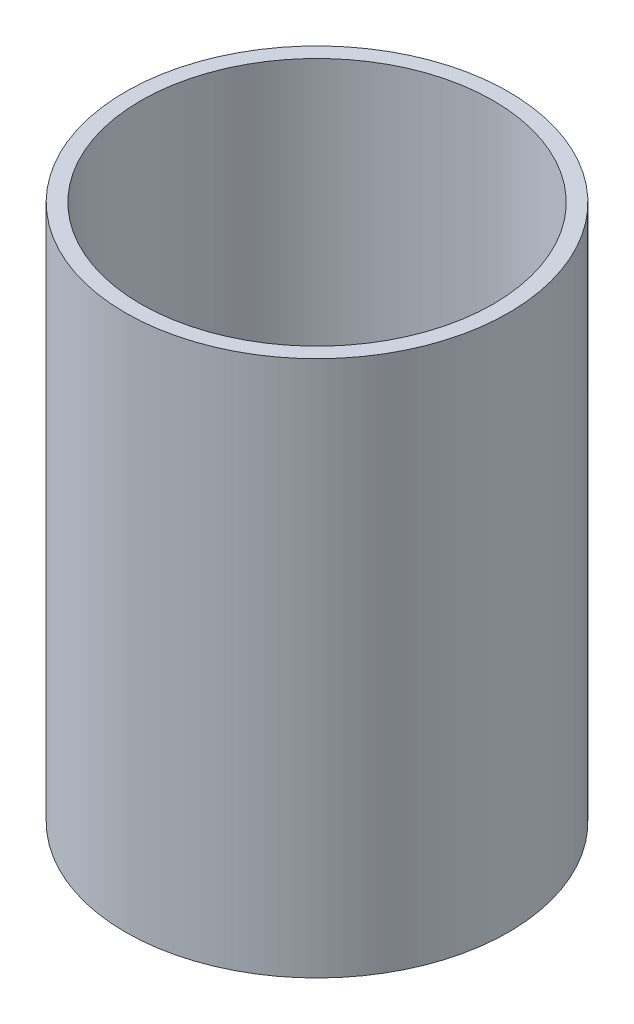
SolidWorks part; units mm, degrees
ref_plane "Front Plane" through (0, 0, 0) normal (0, 0, 1) x (1, 0, 0)
ref_plane "Top Plane" through (0, 0, 0) normal (0, 1, 0) x (1, 0, 0)
ref_plane "Right Plane" through (0, 0, 0) normal (1, 0, 0) x (0, 0, -1)
sketch "Sketch1" plane through (0, 0, 0) normal (0, 1, 0) x (1, 0, 0)
  circle A0 centre (0, 0) radius 12.5
  circle A1 centre (0, 0) radius 11.5
  dimension "D1" = 25
  dimension "D2" = 1
extrude "Extrude1" add sketch "Sketch1" along normal blind 35
